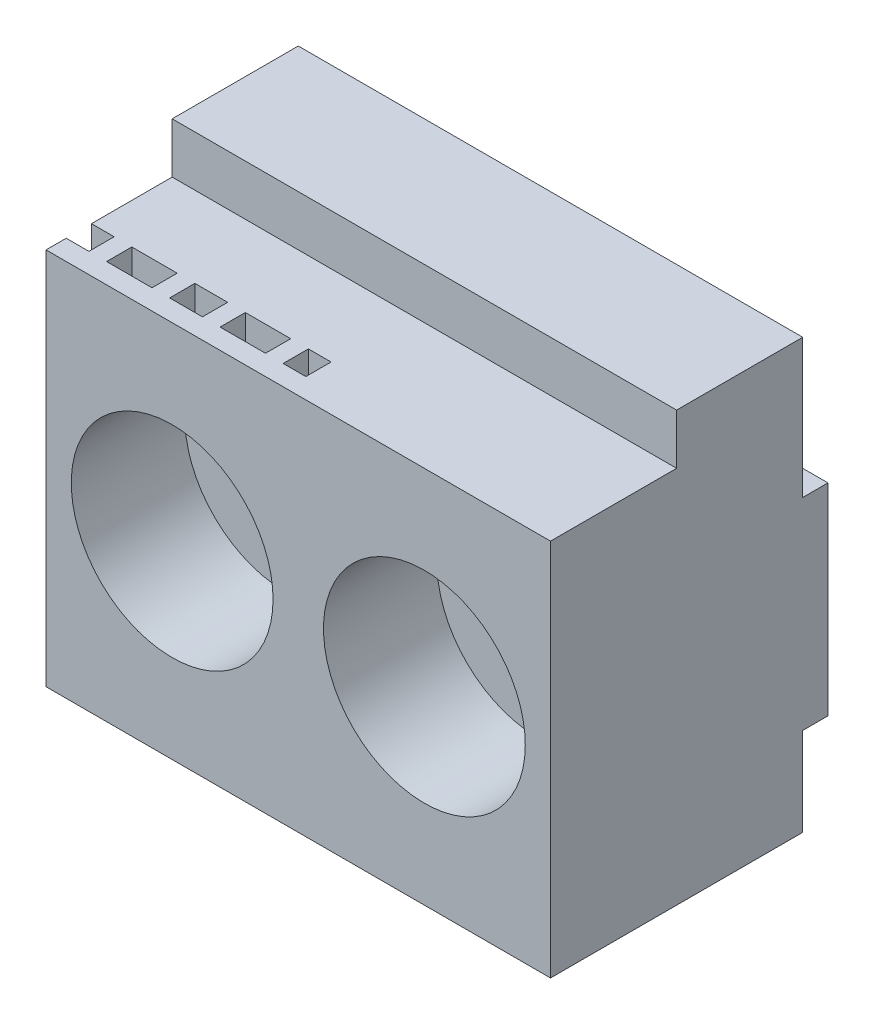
SolidWorks part; units mm, degrees
ref_plane "前视基准面" through (0, 0, 0) normal (0, 0, 1) x (1, 0, 0)
ref_plane "上视基准面" through (0, 0, 0) normal (0, 1, 0) x (1, 0, 0)
ref_plane "右视基准面" through (0, 0, 0) normal (1, 0, 0) x (0, 0, -1)
sketch "草图1" plane through (0, 0, 0) normal (0, 0, 1) x (1, 0, 0)
  line L0 (0, 0) -> (0, 17)
  line L1 (20, 0) -> (20, 17)
  line L2 (0, 0) -> (20, 0)
  line L3 (0, 17) -> (20, 17)
  circle A0 centre (5, 7.5) radius 2.25
  circle A1 centre (15, 7.5) radius 2.25
extrude "凸台-拉伸1" add sketch "草图1" along normal blind 11
sketch "草图2" plane through (0, 0, 11) normal (0, 0, 1) x (1, 0, 0)
  circle A0 centre (5, 7.5) radius 4
  circle A1 centre (15, 7.5) radius 4
extrude "切除-拉伸1" cut sketch "草图2" against normal blind 4.5
sketch "草图3" plane through (20, 0, 0) normal (1, 0, 0) x (0, 0, -1)
  line L0 (-6, 15) -> (-6, 17)
  line L1 (-1, 0) -> (-1, 3.5)
  line L2 (-11, 0) -> (-11, 15)
  line L3 (-11, 0) -> (-1, 0)
  line L4 (-11, 15) -> (-6, 15)
  line L5 (-1, 11.5) -> (0, 11.5)
  line L6 (-1, 3.5) -> (0, 3.5)
  line L7 (0, 3.5) -> (0, 11.5)
  line L8 (-1, 11.5) -> (-1, 17)
  line L9 (-6, 17) -> (-1, 17)
extrude "切除-拉伸2" cut sketch "草图3" against normal through all flip side to cut
sketch "草图4" plane through (0, 15, 0) normal (0, 1, 0) x (1, 0, 0)
  line L0 (0, -10.2) -> (0.9, -10.2)
  line L1 (0, -9.2) -> (0.9, -9.2)
  line L2 (0.9, -10.2) -> (0.9, -9.2)
  line L3 (1.6, -10.2) -> (1.6, -9.2)
  line L4 (3.4, -10.2) -> (3.4, -9.2)
  line L5 (4.1, -10.2) -> (4.1, -9.2)
  line L6 (5.4, -10.2) -> (5.4, -9.2)
  line L7 (6.1, -10.2) -> (6.1, -9.2)
  line L8 (7.9, -10.2) -> (7.9, -9.2)
  line L9 (8.6, -10.2) -> (8.6, -9.2)
  line L10 (8.6, -10.2) -> (9.5, -10.2)
  line L11 (8.6, -9.2) -> (9.5, -9.2)
  line L12 (6.1, -10.2) -> (7.9, -10.2)
  line L13 (6.1, -9.2) -> (7.9, -9.2)
  line L14 (4.1, -10.2) -> (5.4, -10.2)
  line L15 (4.1, -9.2) -> (5.4, -9.2)
  line L16 (1.6, -9.2) -> (3.4, -9.2)
  line L17 (1.6, -10.2) -> (3.4, -10.2)
  line L18 (9.5, -9.2) -> (9.5, -10.2)
  line L19 (0, -9.2) -> (0, -10.2)
extrude "切除-拉伸3" cut sketch "草图4" against normal blind 3
